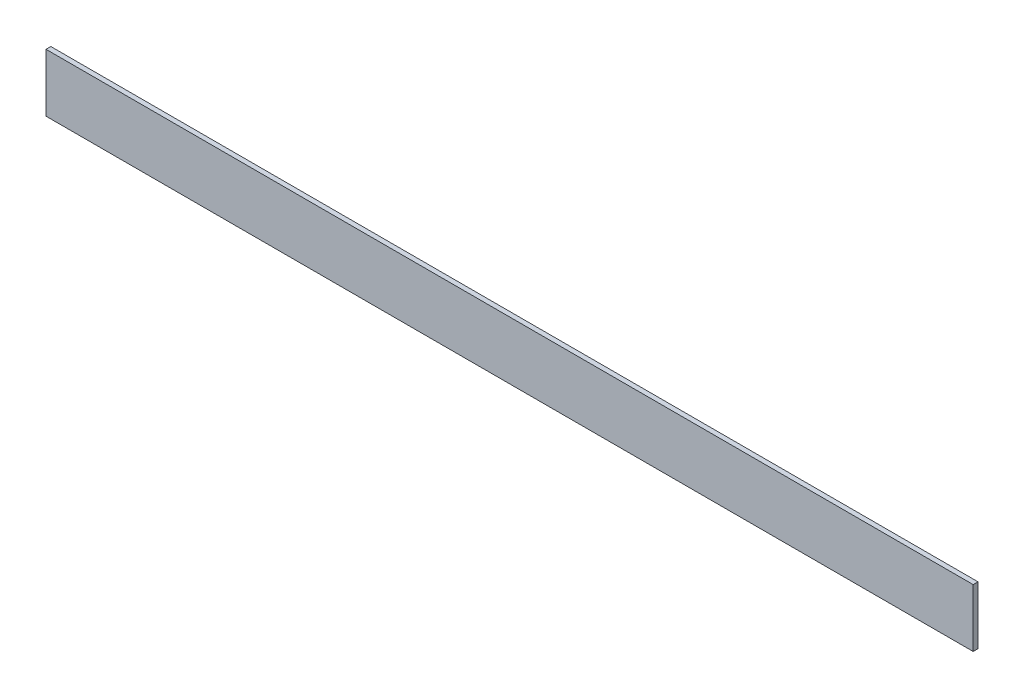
SolidWorks part; units mm, degrees
ref_plane "Front Plane" through (0, 0, 0) normal (0, 0, 1) x (1, 0, 0)
ref_plane "Top Plane" through (0, 0, 0) normal (0, 1, 0) x (1, 0, 0)
ref_plane "Right Plane" through (0, 0, 0) normal (1, 0, 0) x (0, 0, -1)
sketch "Sketch1" plane through (0, 0, 0) normal (0, 0, 1) x (1, 0, 0)
  line L1 (-609.6, -38.1) -> (609.6, -38.1)
  line L2 (-609.6, -38.1) -> (-609.6, 38.1)
  line L3 (-609.6, 38.1) -> (609.6, 38.1)
  line L4 (609.6, -38.1) -> (609.6, 38.1)
  line L5 (-609.6, -38.1) -> (609.6, 38.1) construction
  line L6 (-609.6, 38.1) -> (609.6, -38.1) construction
  point P0 (0, 0)
  dimension "D1" = 76.2
  dimension "D2" = 1219.2
extrude "Boss-Extrude1" add sketch "Sketch1" along normal blind 6.35
